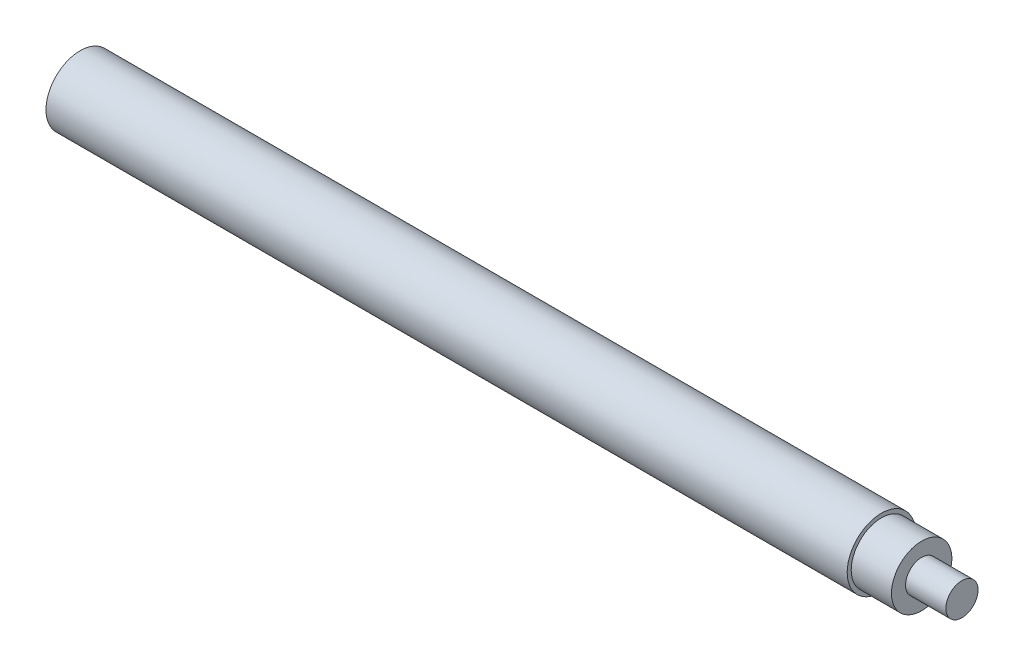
SolidWorks part; units mm, degrees
ref_plane "Front Plane" through (0, 0, 0) normal (0, 0, 1) x (1, 0, 0)
ref_plane "Top Plane" through (0, 0, 0) normal (0, 1, 0) x (1, 0, 0)
ref_plane "Right Plane" through (0, 0, 0) normal (1, 0, 0) x (0, 0, -1)
sketch "Sketch1" plane through (0, 0, 0) normal (0, 0, 1) x (1, 0, 0)
  line L0 (0, 0) -> (219, 0)
  line L1 (219, 0) -> (219, 4)
  line L2 (219, 4) -> (209, 4)
  line L3 (209, 4) -> (209, 7.5)
  line L4 (209, 7.5) -> (199, 7.5)
  line L5 (0, 8.5) -> (0, 0)
  line L6 (199, 7.5) -> (199, 8.5)
  line L7 (199, 8.5) -> (0, 8.5)
  dimension "D1" = 8.5
  dimension "D2" = 219
  dimension "D3" = 10
  dimension "D4" = 4
  dimension "D5" = 7.5
  dimension "D6" = 10
revolve "Revolve1" add sketch "Sketch1" angle 360 about L0
sketch "Sketch2" plane through (0, 0, 0) normal (-1, 0, 0) x (0, 0, 1)
  circle A0 centre (0, 0) radius 2.45
  dimension "D1" = 4.9
extrude "Extrude1" cut sketch "Sketch2" against normal blind 10
